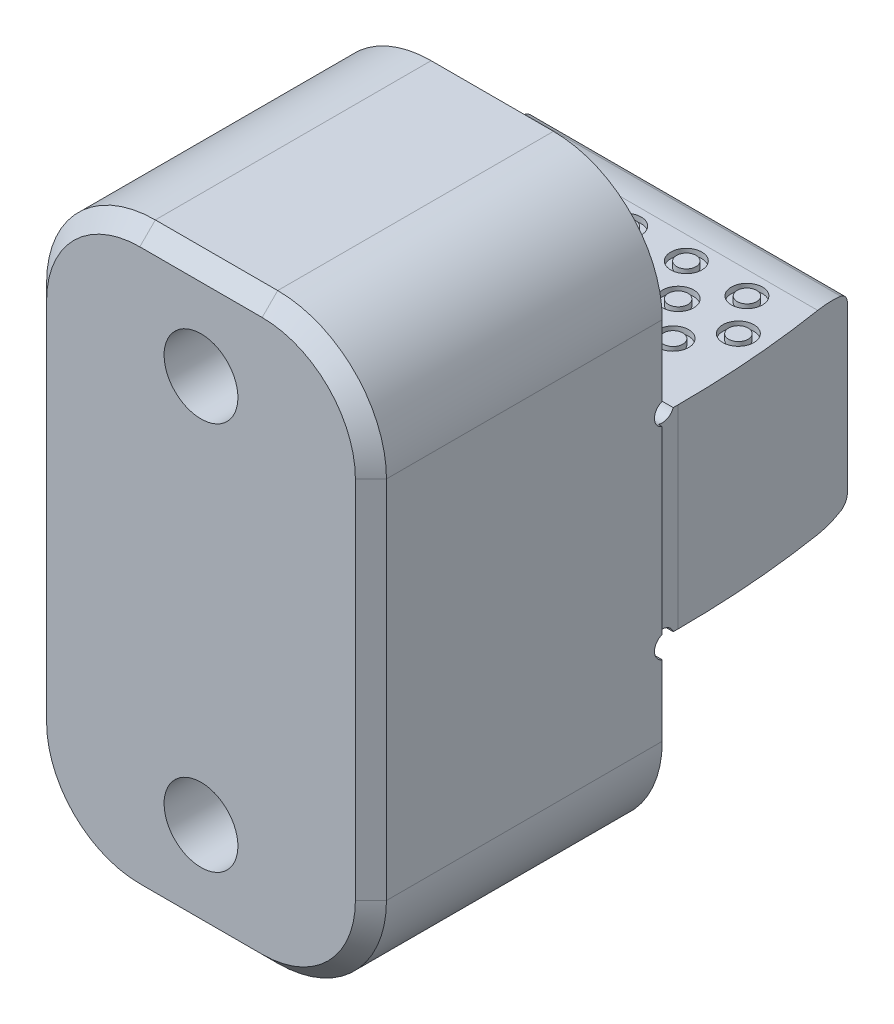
SolidWorks part; units mm, degrees
ref_plane "Front Plane" through (0, 0, 0) normal (0, 0, 1) x (1, 0, 0)
ref_plane "Top Plane" through (0, 0, 0) normal (0, 1, 0) x (1, 0, 0)
ref_plane "Right Plane" through (0, 0, 0) normal (1, 0, 0) x (0, 0, -1)
sketch "Sketch3" plane through (0, 0, 0) normal (1, 0, 0) x (0, 0, -1)
  line L0 (0, 12.2238) -> (0, -12.2238) construction
  line L1 (-19.05, -19.05) -> (0, -19.05)
  line L2 (-19.05, -19.05) -> (-19.05, 19.05)
  line L3 (-19.05, 19.05) -> (0, 19.05)
  line L4 (13.5636, -6.3475) -> (13.5636, 6.3475)
  line L6 (0, -19.05) -> (0, -6.3475)
  line L7 (0, -6.3475) -> (13.5636, -6.3475)
  line L8 (0, 19.05) -> (0, 6.3475)
  line L9 (0, 6.3475) -> (13.5636, 6.3475)
  line L10 (0, 0) -> (50000, 0) construction
  dimension "D1" = 32.6136
  dimension "D2" = 19.05
  dimension "D3" = 38.1
  dimension "D4" = 12.6949
extrude "Extrude1" add sketch "Sketch3" along normal mid plane 22.225
sketch "Sketch7" plane through (11.1125, 0, 0) normal (1, 0, 0) x (0, 0, -1)
  line L1 (0, -14.5526) -> (21.9683, -14.5526)
  line L2 (0, -14.5526) -> (0, 17.1683)
  line L3 (0, 17.1683) -> (21.9683, 17.1683)
  line L4 (21.9683, -14.5526) -> (21.9683, 17.1683)
  line L5 (0, -19.05) -> (0, -6.3475) construction
extrude "Cut-Extrude3" cut sketch "Sketch7" against normal blind 0.254
mirror "Mirror2" about plane through (0, 0, 0) normal (1, 0, 0) of "Cut-Extrude3"
sketch "Sketch8" plane through (11.1125, 0, 0) normal (1, 0, 0) x (0, 0, -1)
  line L0 (0, 0) -> (50000, 0) construction
  line L1 (0, -19.05) -> (0, 19.05) construction
  line L2 (0, 6.3475) -> (13.5636, 6.3475) construction
  circle A0 centre (0.254, 6.6015) radius 0.762
  circle A1 centre (0.254, -6.6015) radius 0.762
  dimension "D1" = 0.762
  dimension "D2" = 0.508
  dimension "D3" = 0.508
extrude "Cut-Extrude4" cut sketch "Sketch8" against normal through all
sketch "Sketch9" plane through (11.1125, 0, 0) normal (1, 0, 0) x (0, 0, -1)
  line L0 (0.9724, 6.3475) -> (13.5636, 6.3475) construction
  line L1 (13.5636, 6.3475) -> (13.5636, -6.3475) construction
  line L2 (0, 0) -> (50000, 0) construction
  line L3 (13.5636, 5.3514) -> (17.5514, 5.3514)
  line L4 (11.2014, 6.3475) -> (11.2014, 11.7014)
  line L5 (11.2014, 11.7014) -> (17.5514, 11.7014)
  line L6 (17.5514, 5.3514) -> (17.5514, 11.7014)
  line L7 (17.5514, -5.3514) -> (17.5514, -11.7014)
  line L8 (11.2014, -11.7014) -> (17.5514, -11.7014)
  line L9 (11.2014, -6.3475) -> (11.2014, -11.7014)
  line L10 (13.5636, -5.3514) -> (17.5514, -5.3514)
  arc A0 (11.2014, 6.3475) -> (13.0198, 6.0815) centre (11.2014, -0.0025) cw
  arc A1 (13.0198, 6.0815) -> (13.5636, 5.3514) centre (12.8016, 5.3514) cw
  arc A2 (13.0198, -6.0815) -> (13.5636, -5.3514) centre (12.8016, -5.3514) ccw
  arc A3 (11.2014, -6.3475) -> (13.0198, -6.0815) centre (11.2014, 0.0025) ccw
  dimension "D1" = 0.762
  dimension "D2" = 6.35
  dimension "D3" = 2.3622
  dimension "D4" = 6.35
  dimension "D5" = 6.35
extrude "Cut-Extrude5" cut sketch "Sketch9" against normal through all
sketch "Sketch13" plane through (0, 19.05, 0) normal (0, 1, 0) x (1, 0, 0)
  line L0 (10.8585, 0.9724) -> (10.8585, 11.2014) construction
  line L2 (9.5755, 13.97) -> (22.2755, 13.97)
  line L4 (10.8585, 1.27) -> (22.2755, 1.27)
  line L5 (22.2755, 13.97) -> (22.2755, 1.27)
  arc A0 (9.5755, 13.97) -> (10.8585, 1.27) centre (-52.6415, 1.27) cw
  dimension "D1" = 63.5
  dimension "D2" = 1.27
  dimension "D3" = 12.7
  dimension "D4" = 12.7
extrude "Cut-Extrude6" cut sketch "Sketch13" against normal through all
sketch "Sketch15" plane through (0, 6.3475, 0) normal (0, 1, 0) x (1, 0, 0)
  line L0 (11.1125, -19.05) -> (-11.1125, -19.05) construction
  line L1 (-11.1125, 11.2014) -> (-11.1125, -0.4644) construction
  circle A0 centre (-4.9403, 9.7028) radius 1.016
  circle A1 centre (-4.9403, 9.7028) radius 0.635
  circle A2 centre (-0.9779, 9.7028) radius 1.016
  circle A3 centre (-0.9779, 9.7028) radius 0.635
  circle A4 centre (-8.9027, 9.7028) radius 1.016
  circle A5 centre (-8.9027, 9.7028) radius 0.635
  circle A6 centre (2.9845, 9.7028) radius 1.016
  circle A7 centre (2.9845, 9.7028) radius 0.635
  circle A8 centre (6.9469, 9.7028) radius 1.016
  circle A9 centre (6.9469, 9.7028) radius 0.635
  circle A10 centre (-3.0099, 7.2898) radius 1.016
  circle A11 centre (-3.0099, 7.2898) radius 0.635
  circle A12 centre (0.9271, 7.2898) radius 1.016
  circle A13 centre (0.9271, 7.2898) radius 0.635
  circle A14 centre (-6.9469, 7.2898) radius 1.016
  circle A15 centre (-6.9469, 7.2898) radius 0.635
  circle A16 centre (4.8641, 7.2898) radius 1.016
  circle A17 centre (4.8641, 7.2898) radius 0.635
  circle A18 centre (8.8011, 7.2898) radius 1.016
  circle A19 centre (8.8011, 7.2898) radius 0.635
  circle A20 centre (-4.9403, 4.8768) radius 1.016
  circle A21 centre (-4.9403, 4.8768) radius 0.635
  circle A22 centre (-0.9779, 4.8768) radius 1.016
  circle A23 centre (-0.9779, 4.8768) radius 0.635
  circle A24 centre (-8.9027, 4.8768) radius 1.016
  circle A25 centre (-8.9027, 4.8768) radius 0.635
  circle A26 centre (2.9845, 4.8768) radius 1.016
  circle A27 centre (2.9845, 4.8768) radius 0.635
  circle A28 centre (6.9469, 4.8768) radius 1.016
  circle A29 centre (6.9469, 4.8768) radius 0.635
  dimension "D1" = 28.7528
  dimension "D2" = 2.413
  dimension "D12" = 3.9624
  dimension "D7" = 2.032
  dimension "D8" = 1.27
  dimension "D3" = 2.413
  dimension "D4" = 2.2098
  dimension "D5" = 4.1656
  dimension "D6" = 3.937
  dimension "D9" = 3.937
  dimension "D10" = 3.937
  dimension "D11" = 3.9624
  dimension "D13" = 3.9624
  dimension "D14" = 3.9624
  dimension "D15" = 3.937
extrude "Cut-Extrude7" cut sketch "Sketch15" against normal blind 0.381
mirror "Mirror1" about plane through (0, 0, 0) normal (0, 1, 0) of "Cut-Extrude7"
hole_wizard "#8 CBORE" positions "Sketch11" profile "Sketch10" counterbore size "#8" standard "Ansi Inch"
sketch "Sketch11" plane through (0, 0, 0) normal (0, 0, -1) x (-1, 0, 0)
  line L0 (0, 0) -> (0, 50000) construction
  line L1 (0, 0) -> (50000, 0) construction
  point P0 (0, 12.7)
  point P10 (0, -12.7)
  dimension "D1" = 25.4
sketch "Sketch10" plane through (0, 12.7, 0) normal (1, 0, 0) x (0, 1, 0)
  line L0 (0, 0) -> (0, 19.05)
  line L1 (0, 19.05) -> (1.905, 19.05)
  line L3 (1.905, 19.05) -> (1.905, 4.9606)
  line L4 (1.905, 4.9606) -> (3.9687, 4.9606)
  line L5 (3.9687, 4.9606) -> (3.9687, 0)
  line L7 (3.9687, 0) -> (0, 0)
  line L11 (0, -6.35) -> (0, 107.95) construction
  dimension "Thru Hole Dia." = 3.81
  dimension "Thru Hole Depth" = 19.05
  dimension "C'Bore Dia." = 7.9375
  dimension "C'Bore Depth" = 4.9606
hole_wizard "#10-32 Tapped Hole1" positions "Sketch17" profile "Sketch16" tap size "#10-32" standard "Ansi Inch"
sketch "Sketch17" plane through (0, 0, 4.9606) normal (0, 0, -1) x (-1, 0, 0)
  point P0 (0, -12.7)
  point P1 (0, 12.7)
sketch "Sketch16" plane through (0, -12.7, 4.9606) normal (1, 0, 0) x (0, 1, 0)
  line L0 (0, 0) -> (0, 14.0894)
  line L1 (0, 14.0894) -> (2.413, 14.0894)
  line L2 (2.413, 14.0894) -> (2.413, 0)
  line L5 (2.413, 0) -> (0, 0)
  line L11 (0, -6.35) -> (0, 107.95) construction
  dimension "Thread Major Dia." = 4.826
  dimension "Thru Tap Drill Depth" = 14.0894
fillet "Fillet1" radius 7.112 4 edges at (-11.1125, 19.05, 9.525) (-11.1125, -19.05, 9.525) (11.1125, -19.05, 9.525) (11.1125, 19.05, 9.525)
chamfer "Chamfer1" distance 1.016 angle 45 8 edges at (0, 19.05, 19.05) (-9.0294, 16.9669, 19.05) (-11.1125, 0, 19.05) (0, -19.05, 19.05) (-9.0294, -16.9669, 19.05) (11.1125, 0, 19.05) (9.0294, 16.9669, 19.05) (9.0294, -16.9669, 19.05)
